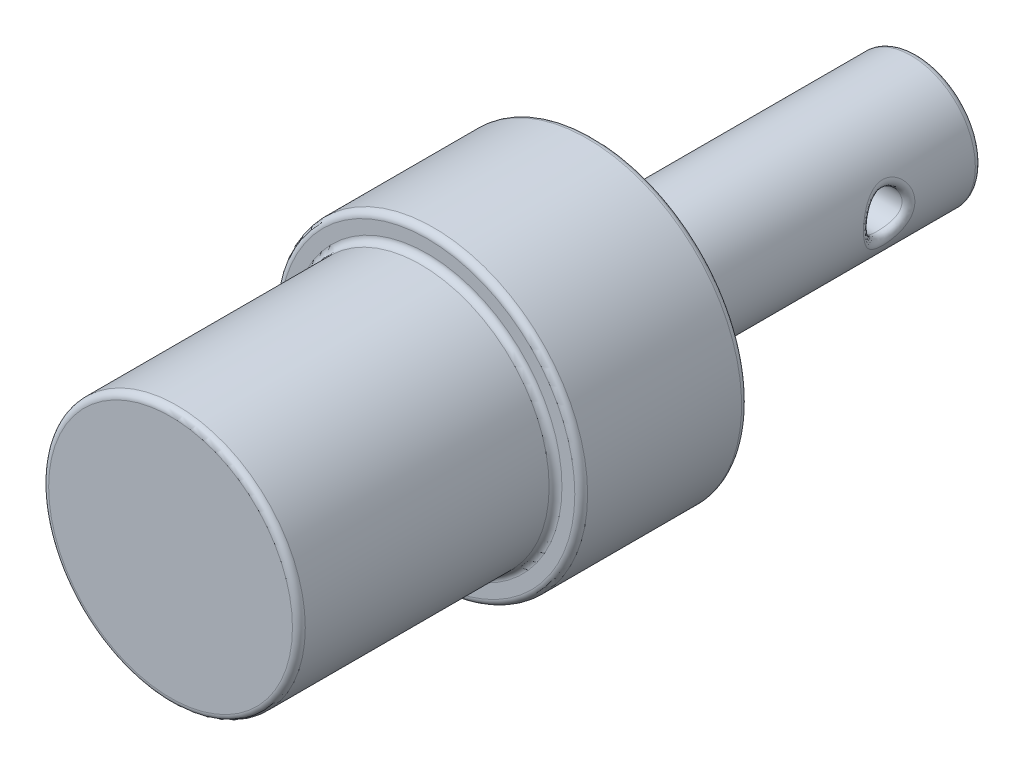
SolidWorks part; units mm, degrees
ref_plane "Спереди" through (0, 0, 0) normal (0, 0, 1) x (1, 0, 0)
ref_plane "Сверху" through (0, 0, 0) normal (0, 1, 0) x (1, 0, 0)
ref_plane "Справа" through (0, 0, 0) normal (1, 0, 0) x (0, 0, -1)
sketch "Эскиз1" plane through (0, 0, 0) normal (1, 0, 0) x (0, 0, -1)
  line L0 (61, 0) -> (0, 0)
  line L1 (0, 0) -> (0, 10)
  line L2 (0, 10) -> (20, 10)
  line L3 (20, 10) -> (20, 12)
  line L4 (20, 12) -> (33, 12)
  line L5 (33, 12) -> (33, 5)
  line L6 (33, 5) -> (57.9957, 5)
  line L7 (57.9957, 5) -> (61, 0)
  dimension "D1" = 10
  dimension "D2" = 12
  dimension "D3" = 20
  dimension "D4" = 13
  dimension "D5" = 28
  dimension "D6" = 59
  dimension "D7" = 5
revolve "Повернуть1" add sketch "Эскиз1" angle 360 about L0
sketch "Эскиз2" plane through (0, 0, 0) normal (1, 0, 0) x (0, 0, -1)
  line L0 (33, -5) -> (33, 5) construction
  circle A0 centre (51, 0) radius 1.5
  dimension "D2" = 3
  dimension "D1" = 18
extrude "Вырез-Вытянуть1" cut sketch "Эскиз2" against normal mid plane 10
fillet "Скругление1" radius 0.5 8 edges at (-5, 0, -57.9957) (-5, 0, -33) (-4.9926, 0.2714, -49.5248) (4.9926, -0.2714, -49.5248) (-12, 0, -33) (-12, 0, -20) (-10, 0, -20) (-10, 0, 0)
